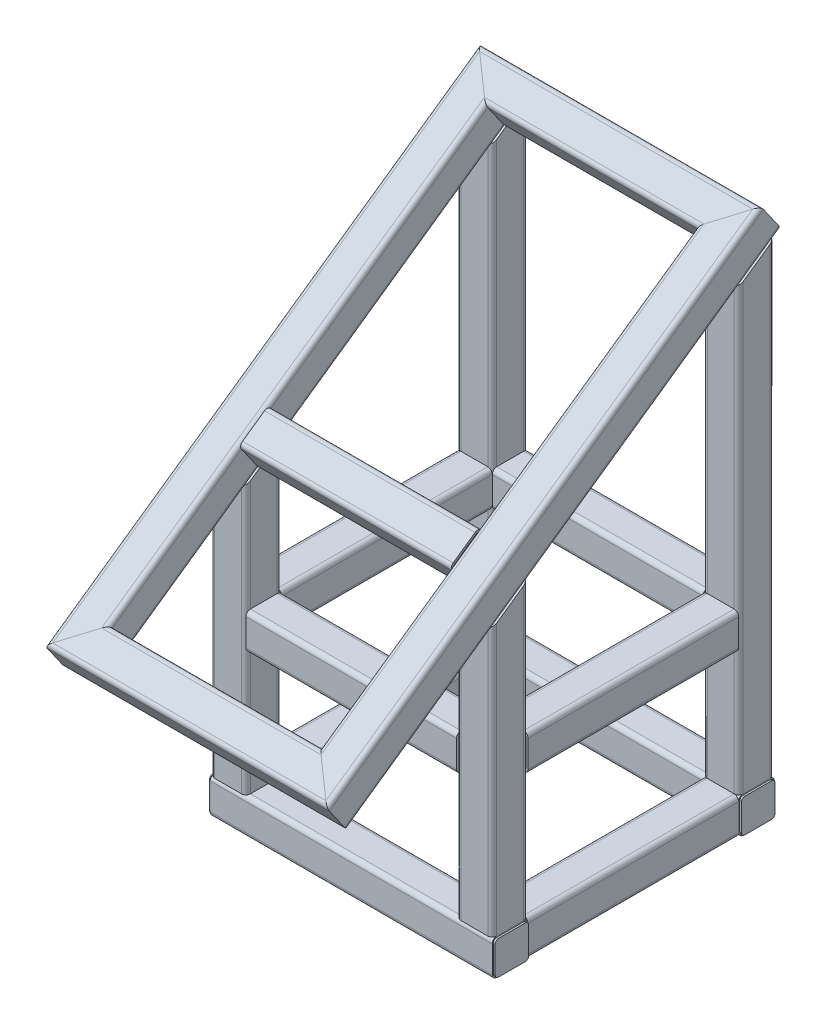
SolidWorks part; units mm, degrees
ref_plane "Front Plane" through (0, 0, 0) normal (0, 0, 1) x (1, 0, 0)
ref_plane "Top Plane" through (0, 0, 0) normal (0, 1, 0) x (1, 0, 0)
ref_plane "Right Plane" through (0, 0, 0) normal (1, 0, 0) x (0, 0, -1)
sketch "Sketch1" plane through (0, 0, 0) normal (1, 0, 0) x (0, 0, -1)
  line L0 (0, 0) -> (0, 1400)
  line L1 (0, 1400) -> (-1150.5336, 594.3877)
  line L2 (0, 0) -> (-700, 0)
  line L3 (-700, 0) -> (-700, 909.8547)
  line L4 (-700, 454.9274) -> (0, 454.9274)
  dimension "D1" = 700
  dimension "D2" = 1400
  dimension "D3" = 55
  dimension "D4" = 550
ref_plane "Plane1" through (700, 0, 0) normal (1, 0, 0) x (0, 0, -1)
sketch "Sketch2" plane through (700, 0, 0) normal (1, 0, 0) x (0, 0, -1)
  line L0 (-700, 454.9274) -> (0, 454.9274) construction
  line L1 (0, 1400) -> (-1150.5336, 594.3877) construction
  line L2 (0, 0) -> (0, 1400) construction
  line L3 (0, 0) -> (-700, 0) construction
  line L4 (-700, 0) -> (-700, 909.8547) construction
  line L5 (-700, 454.9274) -> (0, 454.9274)
  line L6 (0, 1400) -> (-1150.5336, 594.3877)
  line L7 (0, 0) -> (0, 1400)
  line L8 (0, 0) -> (-700, 0)
  line L9 (-700, 0) -> (-700, 909.8547)
sketch3d "3DSketch1"
  line L0 (0, 0, 700) -> (700, 0, 700)
  line L1 (0, 594.3877, 1150.5336) -> (700, 594.3877, 1150.5336)
  line L2 (0, 909.8547, 700) -> (700, 909.8547, 700)
  line L3 (0, 1400, 0) -> (700, 1400, 0)
  line L4 (0, 454.9274, 700) -> (700, 454.9274, 700)
  line L5 (0, 454.9274, 0) -> (700, 454.9274, 0)
  line L6 (0, 0, 0) -> (700, 0, 0)
other "Square tube - configured 4 X 4 X 0.25(1)"
ref_plane "Plane2" through (0, 1400, 0) normal (0, -0.5736, 0.8192) x (0, -0.8192, -0.5736)
sketch "Sketch11" plane through (0, 1400, 0) normal (0, -0.5736, 0.8192) x (0, -0.8192, -0.5736)
  line L0 (-38.1, -44.45) -> (38.1, -44.45)
  line L1 (-44.45, -38.1) -> (-44.45, 38.1)
  line L2 (38.1, 44.45) -> (-38.1, 44.45)
  line L3 (44.45, 38.1) -> (44.45, -38.1)
  line L4 (-38.1, -50.8) -> (38.1, -50.8)
  line L5 (-50.8, -38.1) -> (-50.8, 38.1)
  line L6 (38.1, 50.8) -> (-38.1, 50.8)
  line L7 (50.8, 38.1) -> (50.8, -38.1)
  line L8 (0, 0) -> (44.45, 0) construction
  line L9 (0, 0) -> (0, 44.45) construction
  arc A0 (50.8, 38.1) -> (38.1, 50.8) centre (38.1, 38.1) ccw
  arc A1 (38.1, -50.8) -> (50.8, -38.1) centre (38.1, -38.1) ccw
  arc A2 (-50.8, -38.1) -> (-38.1, -50.8) centre (-38.1, -38.1) ccw
  arc A3 (-38.1, 50.8) -> (-50.8, 38.1) centre (-38.1, 38.1) ccw
  arc A4 (-38.1, 44.45) -> (-44.45, 38.1) centre (-38.1, 38.1) ccw
  arc A5 (44.45, 38.1) -> (38.1, 44.45) centre (38.1, 38.1) ccw
  arc A6 (38.1, -44.45) -> (44.45, -38.1) centre (38.1, -38.1) ccw
  arc A7 (-44.45, -38.1) -> (-38.1, -44.45) centre (-38.1, -38.1) ccw
  point P3 (0, 50.8)
  point P4 (50.8, 0)
  point P5 (0, -50.8)
  point P6 (-50.8, 0)
  point P7 (-50.8, 50.8)
  point P8 (-50.8, -50.8)
  point P33 (0, 0)
  point P35 (50.8, -50.8)
  point P36 (50.8, 50.8)
  point P37 (0, 0)
  dimension "D1" = 12.7
  dimension "Thickness" = 6.35
  dimension "V_leg" = 101.6
other "End cap1" parameters "D1"=5, "D2"=5, "D3"=10, "D4"=0
